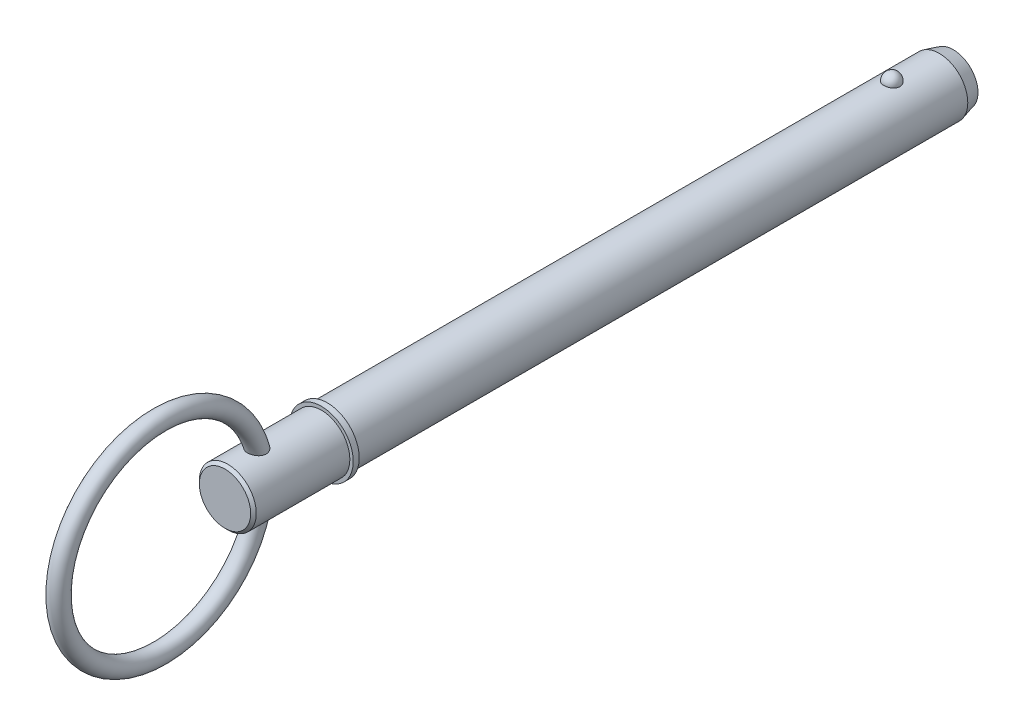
SolidWorks part; units mm, degrees
ref_plane "Front Plane" through (0, 0, 0) normal (0, 0, 1) x (1, 0, 0)
ref_plane "Top Plane" through (0, 0, 0) normal (0, 1, 0) x (1, 0, 0)
ref_plane "Right Plane" through (0, 0, 0) normal (1, 0, 0) x (0, 0, -1)
sketch "Sketch2" plane through (0, 0, 0) normal (0, 0, 1) x (1, 0, 0)
  circle A0 centre (0, 0) radius 7.145
  point P3 (0, 7.145)
  dimension "D1" = 14.29
extrude "Boss-Extrude1" add sketch "Sketch2" along normal blind 139.7
sketch "Sketch3" plane through (0, 0, 0) normal (0, 0, -1) x (-1, 0, 0)
  circle A0 centre (0, 0) radius 7.145
  dimension "D1" = 14.29
extrude "Boss-Extrude2" add sketch "Sketch3" along normal blind 17.45
chamfer "Chamfer1" distance 3.5 angle 15 1 edges at (-7.145, 0, -17.45)
sketch "Sketch18" plane through (0, 0, 0) normal (1, 0, 0) x (0, 0, -1)
  line L0 (13.95, 7.145) -> (-139.7, 7.145) construction
  line L1 (2.02, 9.165) -> (2.02, 5.125)
  line L2 (-139.7, -7.145) -> (13.95, -7.145) construction
  arc A0 (2.02, 9.165) -> (2.02, 5.125) centre (2.02, 7.145) ccw
  point P4 (0, 7.145)
  dimension "D1" = 16.31
revolve "Revolve1" add sketch "Sketch18" angle 360 about L1
sketch "Sketch19" plane through (0, 0, 0) normal (1, 0, 0) x (0, 0, -1)
  line L0 (-33.7288, 0) -> (-46.4542, 0) construction
sketch "Sketch20" plane through (0, 0, 0) normal (1, 0, 0) x (0, 0, -1)
  line L0 (-139.7, 0) -> (-139.7, 8)
  line L1 (-139.7, 7.145) -> (-139.7, -7.145) construction
  line L2 (-139.7, 8) -> (-141.2, 8)
  line L3 (-141.2, 8) -> (-141.2, 0)
  line L4 (-33.7288, 0) -> (-46.4542, 0) construction
  line L5 (-141.2, 0) -> (-139.7, 0)
  dimension "D1" = 8
  dimension "D2" = 1.5
revolve "Revolve2" add sketch "Sketch20" angle 360 about L0
sketch "Sketch21" plane through (0, 0, 139.7) normal (0, 0, -1) x (-1, 0, 0)
  circle A0 centre (0, 0) radius 7.145
  dimension "D1" = 14.29
extrude "Boss-Extrude3" add sketch "Sketch21" against normal blind 25.7
chamfer "Chamfer2" distance 0.7 angle 45 1 edges at (-7.145, 0, 165.4)
sketch "Sketch23" plane through (0, 0, 0) normal (1, 0, 0) x (0, 0, -1)
  line L0 (-165.4, 6.445) -> (-165.4, -6.445) construction
  circle A0 centre (-181.8, 0) radius 25.4
  point P2 (-156.4, 0)
  dimension "D1" = 50.8
  dimension "D2" = 9
sketch "Sketch24" plane through (0, 0, 0) normal (0, 1, 0) x (1, 0, 0)
  circle A0 centre (0, -156.4) radius 2.25
  dimension "D1" = 4.5
sweep "Sweep1" add profiles "Sketch24" path "Sketch23"
